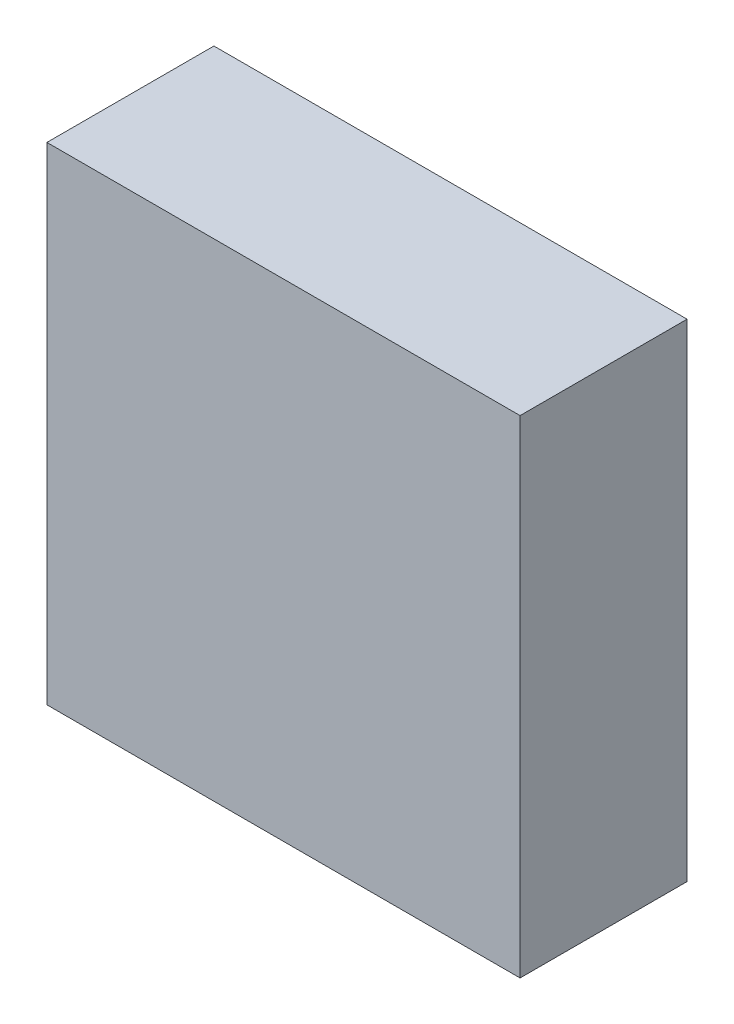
SolidWorks part; units mm, degrees
ref_plane "Спереди" through (0, 0, 0) normal (0, 0, 1) x (1, 0, 0)
ref_plane "Сверху" through (0, 0, 0) normal (0, 1, 0) x (1, 0, 0)
ref_plane "Справа" through (0, 0, 0) normal (1, 0, 0) x (0, 0, -1)
sketch "Эскиз1" plane through (0, 0, 0) normal (0, 0, 1) x (1, 0, 0)
  line L1 (34, -35) -> (-34, -35)
  line L2 (34, -35) -> (34, 35)
  line L3 (34, 35) -> (-34, 35)
  line L4 (-34, -35) -> (-34, 35)
  line L5 (0, 35) -> (0, -35) construction
  line L6 (34, 0) -> (-34, 0) construction
  point P0 (0, 0)
  dimension "D1" = 68
  dimension "D2" = 70
extrude "Бобышка-Вытянуть1" add sketch "Эскиз1" against normal blind 24
hole_wizard "Отверстие обработанное метчиком M121" positions "Эскиз3" profile "Эскиз2" tap size "M12" standard "DIN"
sketch "Эскиз3" plane through (-34, 0, 0) normal (-1, 0, 0) x (0, 0, 1)
  line L0 (-24, -35) -> (0, -35) construction
  line L1 (0, 0) -> (-32.2572, 0) construction
  point P0 (-12, 23)
  point P2 (-12, -23)
  point P8 (-12, -35)
  dimension "D1" = 46
sketch "Эскиз2" plane through (-34, 23, -12) normal (0, 1, 0) x (0, 0, 1)
  line L0 (0, 0) -> (0, 35.0644)
  line L1 (0, 35.0644) -> (5.1, 32)
  line L2 (5.1, 32) -> (5.1, 0)
  line L5 (5.1, 0) -> (0, 0)
  line L10 (0, 35.0644) -> (-5.1, 32) construction
  line L11 (0, -6.35) -> (0, 107.95) construction
  dimension "Диаметр сверла" = 10.2
  dimension "Глубина сверла" = 32
  dimension "Угол заточки сверла" = 118
chamfer "Фаска1" distance 1.6 angle 45 2 edges at (-34, -23, -6.9) (-34, 23, -6.9)
